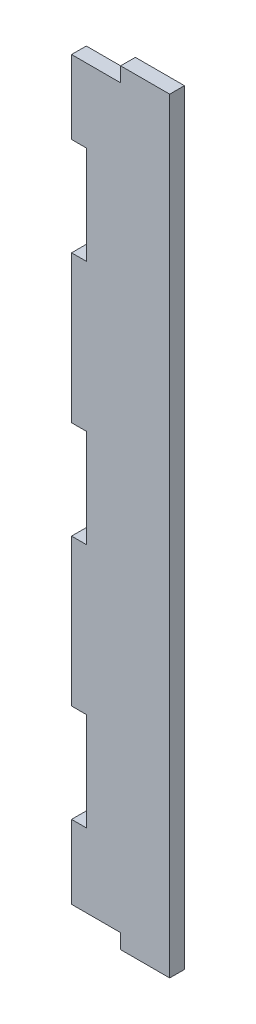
SolidWorks part; units mm, degrees
ref_plane "前视基准面" through (0, 0, 0) normal (0, 0, 1) x (1, 0, 0)
ref_plane "上视基准面" through (0, 0, 0) normal (0, 1, 0) x (1, 0, 0)
ref_plane "右视基准面" through (0, 0, 0) normal (1, 0, 0) x (0, 0, -1)
sketch "草图1" plane through (0, 0, 0) normal (0, 0, 1) x (1, 0, 0)
  line L1 (-10, -75) -> (10, -75)
  line L2 (-10, -75) -> (-10, 75)
  line L3 (-10, 75) -> (10, 75)
  line L4 (10, -75) -> (10, 75)
  line L5 (-10, -75) -> (10, 75) construction
  line L6 (-10, 75) -> (10, -75) construction
  point P0 (0, 0)
  dimension "D1" = 20
  dimension "D2" = 150
extrude "凸台-拉伸1" add sketch "草图1" along normal blind 3
sketch "草图2" plane through (0, 0, 0) normal (0, 0, 1) x (1, 0, 0)
  line L1 (10, 75) -> (-10, 75) construction
  line L3 (-10, 0) -> (10, 0) construction
  line L4 (0, 75) -> (10, 75)
  line L5 (0, 75) -> (0, 78)
  line L6 (0, 78) -> (10, 78)
  line L7 (10, 75) -> (10, 78)
  line L8 (-10, 75) -> (-10, -75) construction
  line L9 (10, -75) -> (10, 75) construction
  line L10 (10, -75) -> (10, -78)
  line L11 (0, -78) -> (10, -78)
  line L12 (0, -75) -> (0, -78)
  line L13 (0, -75) -> (10, -75)
  point P0 (15, 75)
  dimension "D1" = 10
  dimension "D2" = 3
extrude "凸台-拉伸2" add sketch "草图2" along normal blind 3
sketch "草图3" plane through (0, 0, 3) normal (0, 0, 1) x (1, 0, 0)
  line L0 (-10, 0) -> (10, 0) construction
  line L1 (-10, 75) -> (-10, -75) construction
  line L2 (10, -78) -> (10, 78) construction
  line L3 (-7, -60) -> (-7, -40)
  line L4 (-10, 10) -> (-7, 10)
  line L5 (-10, 10) -> (-10, -10)
  line L6 (-10, -10) -> (-7, -10)
  line L7 (-7, 10) -> (-7, -10)
  line L8 (-10, 60) -> (-7, 60)
  line L9 (-10, 60) -> (-10, 40)
  line L10 (-10, 40) -> (-7, 40)
  line L11 (-7, 60) -> (-7, 40)
  line L12 (-10, -40) -> (-7, -40)
  line L13 (-10, -60) -> (-10, -40)
  line L14 (-10, -60) -> (-7, -60)
  dimension "D1" = 3
  dimension "D2" = 20
  dimension "D3" = 20
  dimension "D4" = 80
  dimension "D5" = 3
extrude "切除-拉伸1" cut sketch "草图3" against normal blind 3
